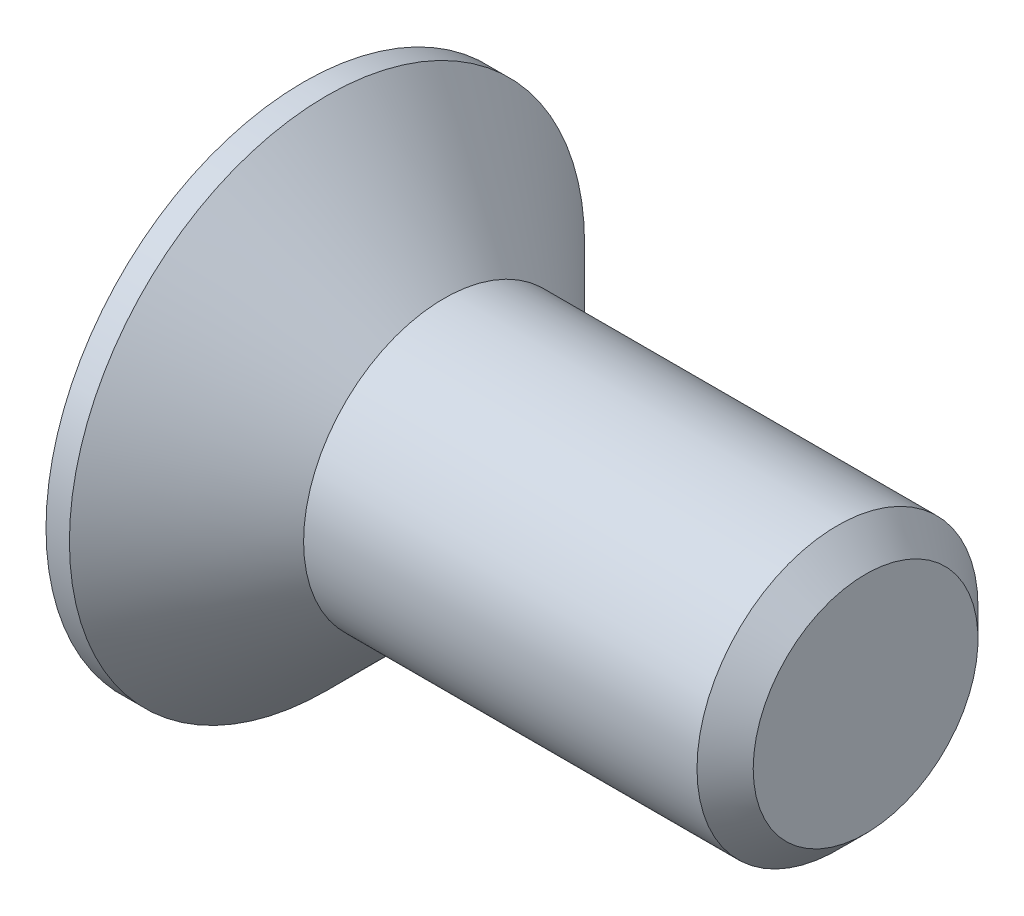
SolidWorks part; units mm, degrees
ref_plane "Front Plane" through (0, 0, 0) normal (0, 0, 1) x (1, 0, 0)
ref_plane "Top Plane" through (0, 0, 0) normal (0, 1, 0) x (1, 0, 0)
ref_plane "Right Plane" through (0, 0, 0) normal (1, 0, 0) x (0, 0, -1)
sketch "Sketch1" plane through (0, 0, 0) normal (0, 0, 1) x (1, 0, 0)
  line L1 (-3, 5.5) -> (-3, 0)
  line L2 (-3, 0) -> (9, 0)
  line L3 (9, 0) -> (9, 3)
  line L4 (9, 3) -> (0, 3)
  line L5 (-3, 5.5) -> (-2.5, 5.5)
  line L6 (-2.5, 5.5) -> (0, 3)
  dimension "D1" = 3
  dimension "D2" = 45
  dimension "D3" = 3
  dimension "D4" = 12
  dimension "D5" = 5.5
revolve "Revolve1" add sketch "Sketch1" angle 360 about L2
chamfer "Chamfer1" distance 0.6 angle 45 1 edges at (9, 0, 3)
sketch "Sketch2" plane through (-3, 0, 0) normal (-1, 0, 0) x (0, 0, 1)
  line L0 (-0.825, 3.3) -> (0.825, 3.3)
  line L1 (0.825, 3.3) -> (0.825, 0.825)
  line L2 (0.825, 0.825) -> (3.3, 0.825)
  line L3 (3.3, 0.825) -> (3.3, -0.825)
  line L4 (3.3, -0.825) -> (0.825, -0.825)
  line L5 (0.825, -0.825) -> (0.825, -3.3)
  line L6 (0.825, -3.3) -> (-0.825, -3.3)
  line L7 (-0.825, -3.3) -> (-0.825, -0.825)
  line L8 (-0.825, -0.825) -> (-3.3, -0.825)
  line L9 (-3.3, -0.825) -> (-3.3, 0.825)
  line L10 (-3.3, 0.825) -> (-0.825, 0.825)
  line L11 (-0.825, 0.825) -> (-0.825, 3.3)
  point P2 (0, 3.3)
  point P14 (0, -3.3)
  point P15 (3.3, 0)
  point P16 (-3.3, 0)
  dimension "D1" = 6.6
  dimension "D2" = 1.65
extrude "Cut-Extrude1" cut sketch "Sketch2" against normal blind 2.5
